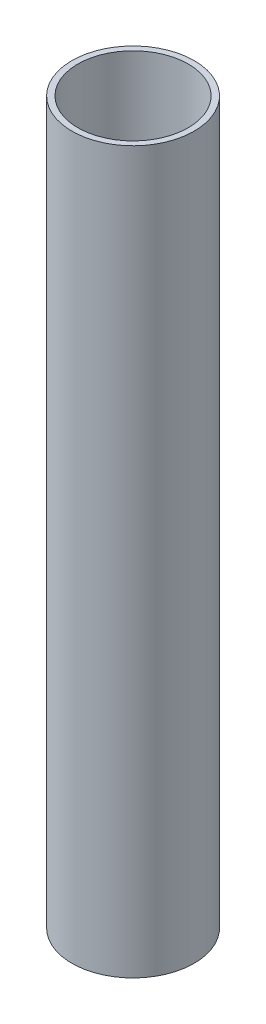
SolidWorks part; units mm, degrees
ref_plane "Front Plane" through (0, 0, 0) normal (0, 0, 1) x (1, 0, 0)
ref_plane "Top Plane" through (0, 0, 0) normal (0, 1, 0) x (1, 0, 0)
ref_plane "Right Plane" through (0, 0, 0) normal (1, 0, 0) x (0, 0, -1)
sketch "Sketch1" plane through (0, 0, 0) normal (0, 1, 0) x (1, 0, 0)
  circle A0 centre (0, 0) radius 6.35 construction
  circle A1 centre (0, 0) radius 7.35 construction
  circle A2 centre (0, 0) radius 8.35 construction
  circle A3 centre (0, 0) radius 9.35
  circle A4 centre (0, 0) radius 10.35
  dimension "D1" = 1
  dimension "D2" = 1
  dimension "D3" = 1
  dimension "D4" = 1
  dimension "D5" = 12.7
extrude "Boss-Extrude1" add sketch "Sketch1" along normal blind 122
